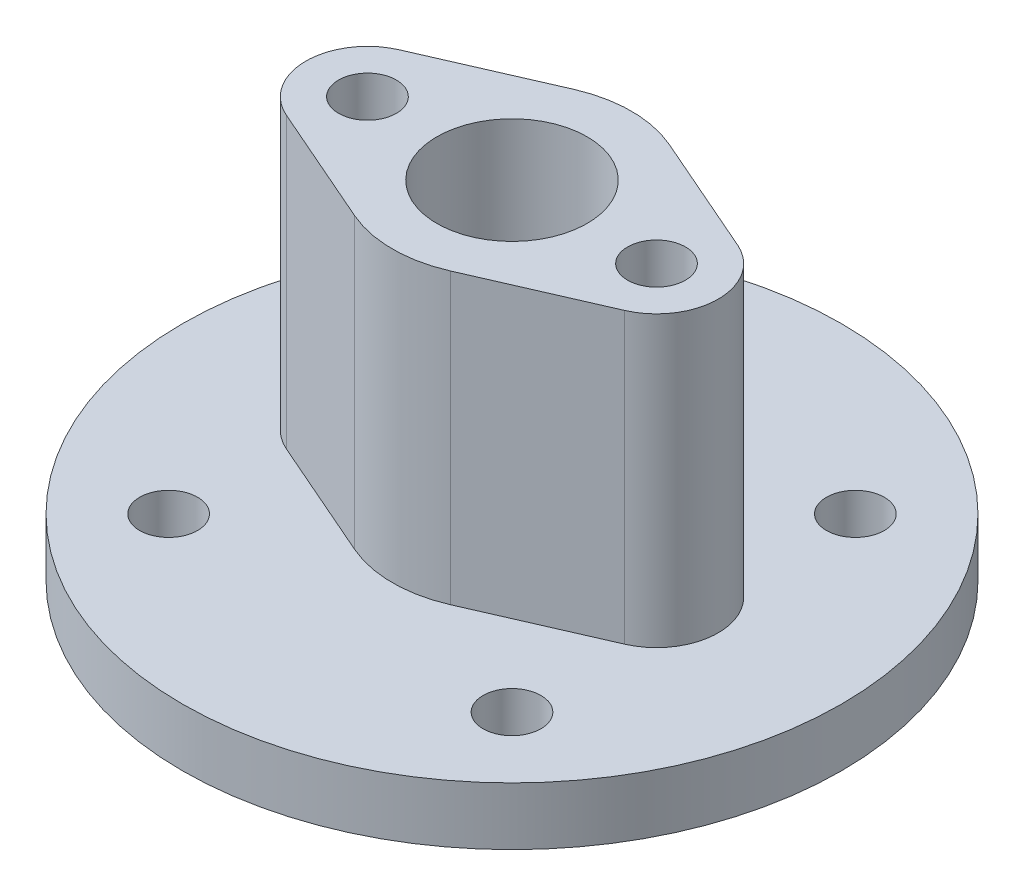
SolidWorks part; units mm, degrees
ref_plane "Front Plane" through (0, 0, 0) normal (0, 0, 1) x (1, 0, 0)
ref_plane "Top Plane" through (0, 0, 0) normal (0, 1, 0) x (1, 0, 0)
ref_plane "Right Plane" through (0, 0, 0) normal (1, 0, 0) x (0, 0, -1)
sketch "Sketch1" plane through (0, 0, 0) normal (0, 0, 1) x (1, 0, 0)
  line L0 (0, 68.6952) -> (0, -38.0888) construction
  line L1 (0, 0) -> (0, 57)
  line L2 (0, 57) -> (85.5, 57)
  line L3 (85.5, 57) -> (85.5, 42)
  line L4 (85.5, 42) -> (42, 42)
  line L5 (42, 42) -> (24, 0)
  line L6 (24, 0) -> (0, 0)
  dimension "D1" = 15
  dimension "D2" = 48
  dimension "D3" = 84
  dimension "D4" = 171
  dimension "D5" = 42
revolve "Revolve1" add sketch "Sketch1" angle 360 about L0
sketch "Sketch2" plane through (0, 57, 0) normal (0, 1, 0) x (1, 0, 0)
  line L0 (-43.9, 14.6642) -> (-12.4, 28.412)
  line L1 (12.4, 28.412) -> (43.9, 14.6642)
  line L2 (-43.9, -14.6642) -> (-12.4, -28.412)
  line L3 (12.4, -28.412) -> (43.9, -14.6642)
  line L4 (0, 45.1614) -> (0, -40.2938) construction
  arc A0 (12.4, 28.412) -> (-12.4, 28.412) centre (0, 0) ccw
  arc A1 (-43.9, 14.6642) -> (-43.9, -14.6642) centre (-37.5, 0) ccw
  arc A2 (43.9, -14.6642) -> (43.9, 14.6642) centre (37.5, 0) ccw
  arc A3 (-12.4, -28.412) -> (12.4, -28.412) centre (0, 0) ccw
  dimension "D2" = 16
  dimension "D3" = 31
  dimension "D1" = 75
extrude "Boss-Extrude1" add sketch "Sketch2" along normal blind 75
sketch "Sketch3" plane through (0, 0, 0) normal (0, 0, 1) x (1, 0, 0)
  line L0 (0, -11.1962) -> (0, 144.737) construction
  line L1 (0, 132) -> (19.5, 132)
  line L2 (12.4, 132) -> (-12.4, 132) construction
  line L4 (19.5, 132) -> (19.5, 102)
  line L5 (19.5, 102) -> (10.5, 102)
  line L6 (10.5, 102) -> (10.5, 90)
  line L7 (10.5, 90) -> (19.5, 90)
  line L8 (19.5, 90) -> (19.5, 66)
  line L9 (19.5, 66) -> (13.5, 66)
  line L10 (13.5, 66) -> (13.5, 0)
  line L11 (-24, 0) -> (24, 0) construction
  line L12 (13.5, 0) -> (0, 0)
  line L13 (0, 0) -> (0, 132)
  dimension "D1" = 39
  dimension "D2" = 21
  dimension "D3" = 27
  dimension "D4" = 30
  dimension "D5" = 24
  dimension "D6" = 12
revolve "Cut-Revolve1" cut sketch "Sketch3" angle 360 about L0
hole_wizard "Ø15.0 (15) Diameter Hole1" positions "Sketch5" profile "Sketch4" hole size "Ø15.0" standard "Ansi Metric"
sketch "Sketch5" plane through (0, 57, 0) normal (0, 1, 0) x (-1, 0, 0)
  line L0 (44.5477, 44.5477) -> (0, 0) construction
  line L1 (0, 0) -> (67.9632, 0) construction
  point P0 (44.5477, 44.5477)
  dimension "D1" = 45
  dimension "D2" = 63
sketch "Sketch4" plane through (-44.5477, 57, 44.5477) normal (1, 0, 0) x (0, 0, 1)
  line L0 (0, 0) -> (0, 15.001)
  line L1 (0, 15.001) -> (7.5, 15.001)
  line L2 (7.5, 15.001) -> (7.5, 0)
  line L5 (7.5, 0) -> (0, 0)
  line L11 (0, -6.35) -> (0, 107.95) construction
  dimension "Thru Hole Dia." = 15
  dimension "Thru Hole Depth" = 15.001
pattern_circular "CirPattern1" count 4 over 360 about axis through (0, 0, 0) along (0, 1, 0) of "Ø15.0 (15) Diameter Hole1"
hole_wizard "Ø15.0 (15) Diameter Hole2" positions "Sketch7" profile "Sketch6" hole size "Ø15.0" standard "Ansi Metric"
sketch "Sketch7" plane through (0, 132, 0) normal (0, 1, 0) x (-1, 0, 0)
  arc A0 (-43.9, 14.6642) -> (-43.9, -14.6642) centre (-37.5, 0) ccw construction
  arc A1 (43.9, -14.6642) -> (43.9, 14.6642) centre (37.5, 0) ccw construction
  point P0 (37.5, 0)
  point P1 (-37.5, 0)
sketch "Sketch6" plane through (-37.5, 132, 0) normal (1, 0, 0) x (0, 0, 1)
  line L0 (0, 0) -> (0, 29.5065)
  line L1 (0, 29.5065) -> (7.5, 25)
  line L2 (7.5, 25) -> (7.5, 0)
  line L5 (7.5, 0) -> (0, 0)
  line L10 (0, 29.5065) -> (-7.5, 25) construction
  line L11 (0, -6.35) -> (0, 107.95) construction
  dimension "Hole Dia." = 15
  dimension "Hole Depth" = 25
  dimension "Drill Angle" = 118
